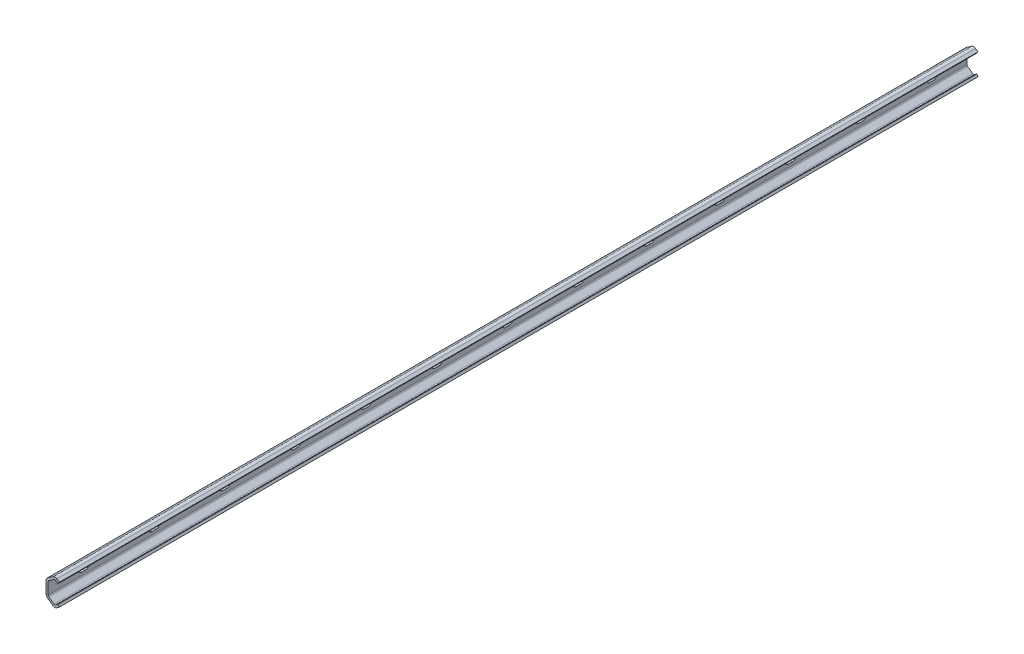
SolidWorks part; units mm, degrees
ref_plane "Front Plane" through (0, 0, 0) normal (0, 0, 1) x (1, 0, 0)
ref_plane "Top Plane" through (0, 0, 0) normal (0, 1, 0) x (1, 0, 0)
ref_plane "Right Plane" through (0, 0, 0) normal (1, 0, 0) x (0, 0, -1)
sketch "Sketch1" plane through (0, 0, 0) normal (0, 0, 1) x (1, 0, 0)
  line L0 (13.5661, -10.1611) -> (15, -12.209)
  line L1 (15, -12.209) -> (12.159, -14.1983)
  line L2 (7.841, -14.1983) -> (2.0723, -10.159)
  line L3 (0, -6.37) -> (0, 6.37)
  line L4 (2.0723, 10.159) -> (7.841, 14.1983)
  line L5 (12.159, 14.1983) -> (15, 12.209)
  line L6 (15, 12.209) -> (13.5661, 10.1611)
  line L7 (13.5661, 10.1611) -> (10.861, 12.0552)
  line L8 (9.139, 12.0552) -> (3.2542, 7.9346)
  line L9 (2.5, 6.37) -> (2.5, -6.37)
  line L10 (3.2542, -7.9346) -> (9.139, -12.0552)
  line L11 (10.861, -12.0552) -> (13.5661, -10.1611)
  arc A0 (12.159, -14.1983) -> (7.841, -14.1983) centre (10, -11.1149) cw
  arc A1 (2.0723, -10.159) -> (0, -6.37) centre (4.8653, -6.1702) cw
  arc A2 (0, 6.37) -> (2.0723, 10.159) centre (4.5, 6.37) cw
  arc A3 (7.841, 14.1983) -> (12.159, 14.1983) centre (10, 11.1149) cw
  arc A4 (10.861, 12.0552) -> (9.139, 12.0552) centre (10, 10.8255) ccw
  arc A5 (3.2542, 7.9346) -> (2.5, 6.37) centre (4.2732, 6.4793) ccw
  arc A6 (2.5, -6.37) -> (3.2542, -7.9346) centre (4.5, -6.37) ccw
  arc A7 (9.139, -12.0552) -> (10.861, -12.0552) centre (10, -10.8255) ccw
  dimension "D1" = 3.7641
  dimension "D2" = 4.8694
  dimension "D3" = 4.5
  dimension "D4" = 3.7641
  dimension "D5" = 1.5011
  dimension "D6" = 1.7766
  dimension "D7" = 2
  dimension "D8" = 1.5011
  dimension "D9" = 2.0723
  dimension "D10" = 2.0723
  dimension "D11" = 2.5
  dimension "D12" = 3.2542
  dimension "D13" = 3.2542
  dimension "D14" = 4.2732
  dimension "D15" = 4.8653
  dimension "D16" = 7.841
  dimension "D17" = 7.841
  dimension "D18" = 4.5
  dimension "D19" = 9.139
  dimension "D20" = 10
  dimension "D21" = 10.861
  dimension "D22" = 6.37
  dimension "D23" = 9.139
  dimension "D24" = 6.1702
  dimension "D27" = 10.861
  dimension "D31" = 13.5661
  dimension "D32" = 13.5661
  dimension "D33" = 15
  dimension "D34" = 15
extrude "Extrude1" add sketch "Sketch1" against normal blind 1040
sketch "Sketch3" plane through (2.5, 0, 0) normal (1, 0, 0) x (0, 0, -1)
  line L0 (37.5, 0) -> (42.5, 0) construction
  line L1 (37.5, 3) -> (42.5, 3)
  line L2 (37.5, -3) -> (42.5, -3)
  arc A0 (37.5, 3) -> (37.5, -3) centre (37.5, 0) ccw
  arc A1 (42.5, 3) -> (42.5, -3) centre (42.5, 0) cw
  point P5 (40, 0)
  dimension "D1" = 5
  dimension "D2" = 6
  dimension "D3" = 40
extrude "Extrude2" cut sketch "Sketch3" against normal through all
pattern_linear "LPattern1" count 13 spacing 80 along (0, 0, -1) of "Extrude2"
